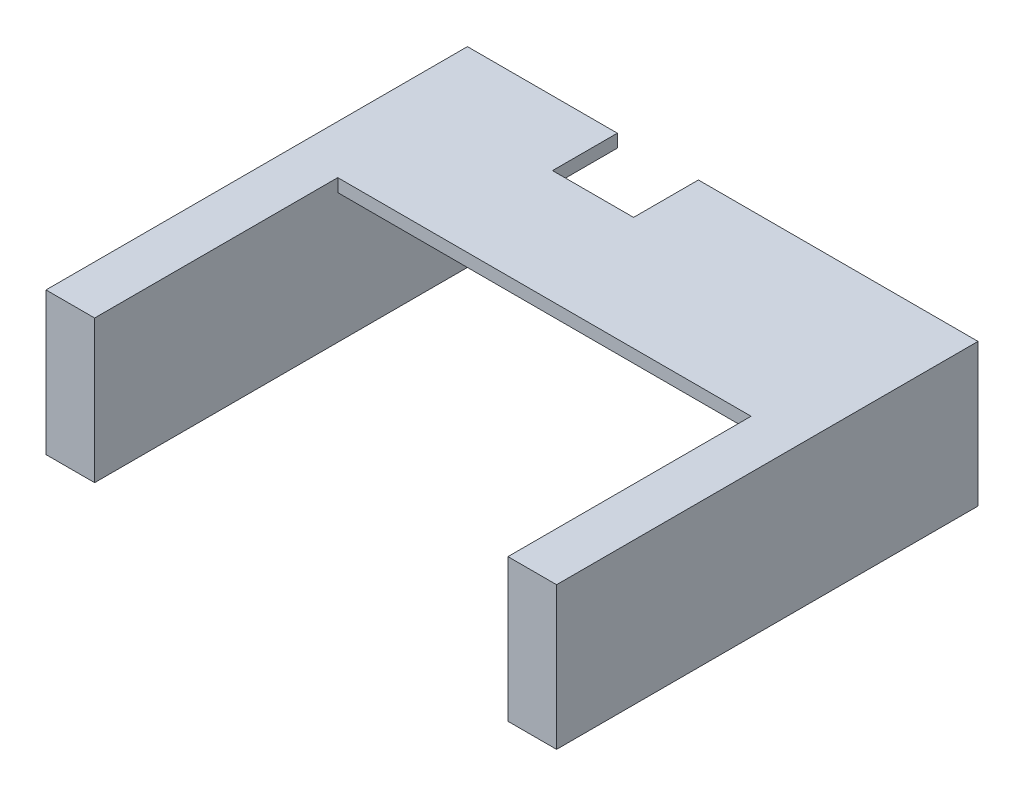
SolidWorks part; units mm, degrees
ref_plane "Plan de face" through (0, 0, 0) normal (0, 0, 1) x (1, 0, 0)
ref_plane "Plan de dessus" through (0, 0, 0) normal (0, 1, 0) x (1, 0, 0)
ref_plane "Plan de droite" through (0, 0, 0) normal (1, 0, 0) x (0, 0, -1)
sketch "Esquisse1" plane through (0, 0, 0) normal (0, 0, 1) x (1, 0, 0)
  line L1 (0, 0) -> (315, 0)
  line L2 (0, 0) -> (0, 88)
  line L3 (0, 88) -> (315, 88)
  line L4 (315, 0) -> (315, 88)
  dimension "D1" = 88
  dimension "D2" = 315
extrude "Boss.-Extru.1" add sketch "Esquisse1" along normal blind 260
sketch "Esquisse3" plane through (0, 0, 260) normal (0, 0, 1) x (1, 0, 0)
  line L0 (0, 0) -> (315, 0) construction
  line L1 (30, 0) -> (285, 0)
  line L2 (30, 0) -> (30, 80)
  line L3 (30, 80) -> (285, 80)
  line L4 (285, 0) -> (285, 80)
  line L5 (0, 88) -> (0, 0) construction
  line L6 (315, 0) -> (315, 88) construction
  dimension "D1" = 30
  dimension "D2" = 30
  dimension "D3" = 80
extrude "Enlèv. mat.-Extru.1" cut sketch "Esquisse3" against normal through all
sketch "Esquisse4" plane through (0, 80, 0) normal (0, -1, 0) x (1, 0, 0)
  line L0 (285, 0) -> (285, 260) construction
  line L1 (30, 260) -> (285, 260)
  line L2 (30, 260) -> (30, 110)
  line L3 (30, 110) -> (285, 110)
  line L4 (285, 260) -> (285, 110)
  dimension "D1" = 150
extrude "Enlèv. mat.-Extru.2" cut sketch "Esquisse4" against normal through all
sketch "Esquisse5" plane through (0, 88, 0) normal (0, 1, 0) x (1, 0, 0)
  line L0 (157.5, 0) -> (157.5, -259.1407) construction
  line L1 (315, 0) -> (0, 0) construction
  line L2 (117.5, 0) -> (117.5, -259.1407) construction
  line L3 (197.5, 0) -> (197.5, -259.1407) construction
  line L5 (142.5, 0) -> (92.5, 0)
  line L6 (142.5, 0) -> (142.5, -40)
  line L7 (142.5, -40) -> (92.5, -40)
  line L8 (92.5, 0) -> (92.5, -40)
  circle A0 centre (157.5, -177.235) radius 170 construction
  dimension "D1" = 340
  dimension "D2" = 40
  dimension "D3" = 40
  dimension "D4" = 40
  dimension "D5" = 25
  dimension "D6" = 25
extrude "Enlèv. mat.-Extru.3" cut sketch "Esquisse5" against normal through all
